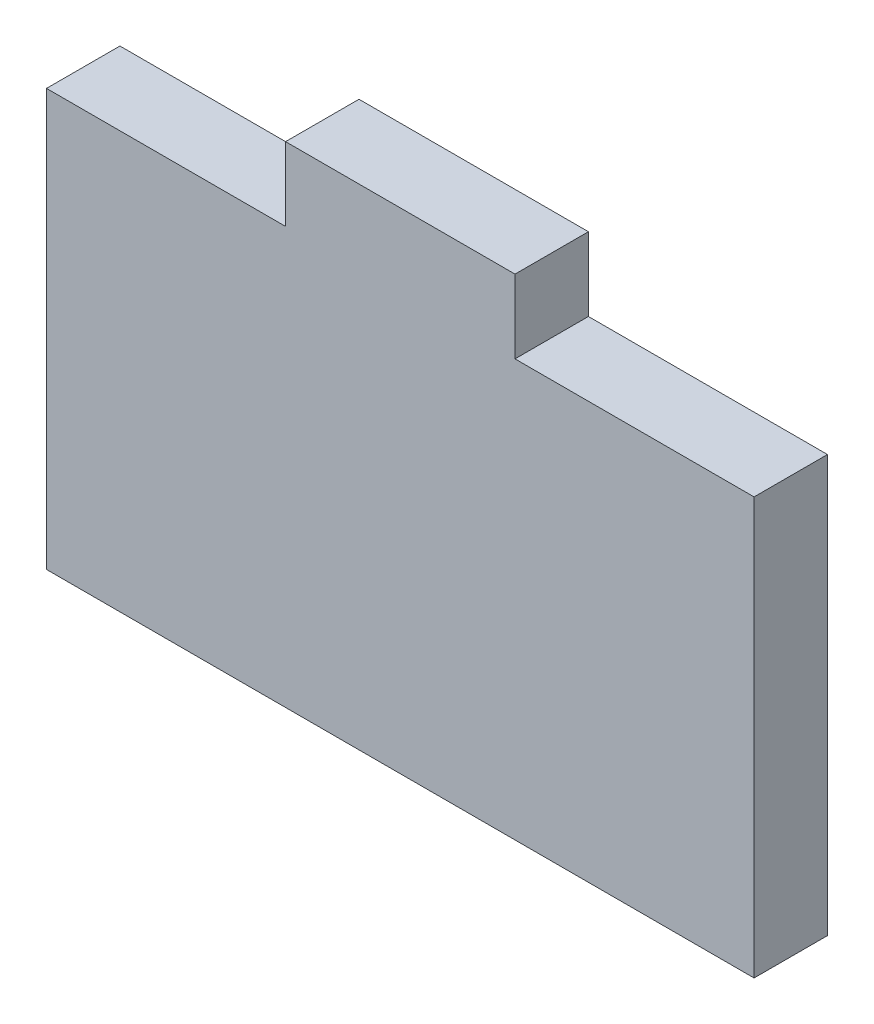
SolidWorks part; units mm, degrees
ref_plane "Front Plane" through (0, 0, 0) normal (0, 0, 1) x (1, 0, 0)
ref_plane "Top Plane" through (0, 0, 0) normal (0, 1, 0) x (1, 0, 0)
ref_plane "Right Plane" through (0, 0, 0) normal (1, 0, 0) x (0, 0, -1)
sketch "Sketch1" plane through (0, 0, 0) normal (0, 0, 1) x (1, 0, 0)
  line L1 (0, 0) -> (154.2, 0)
  line L2 (0, 0) -> (0, 90.8)
  line L3 (0, 90.8) -> (154.2, 90.8)
  line L4 (154.2, 0) -> (154.2, 90.8)
  line L5 (52.1, 90.8) -> (102.1, 90.8)
  line L6 (52.1, 90.8) -> (52.1, 106.8)
  line L7 (52.1, 106.8) -> (102.1, 106.8)
  line L8 (102.1, 90.8) -> (102.1, 106.8)
  point P9 (77.1, 106.8)
  point P10 (77.1, 90.8)
extrude "Boss-Extrude1" add sketch "Sketch1" along normal blind 16 contours L2 L3 L4 L1 | L7 L8 L5 L6
equation "\"thk\"= 16mm"
equation "\"D3@Sketch1\"=\"thk\""
equation "\"D1@Boss-Extrude1\"=\"thk\""
